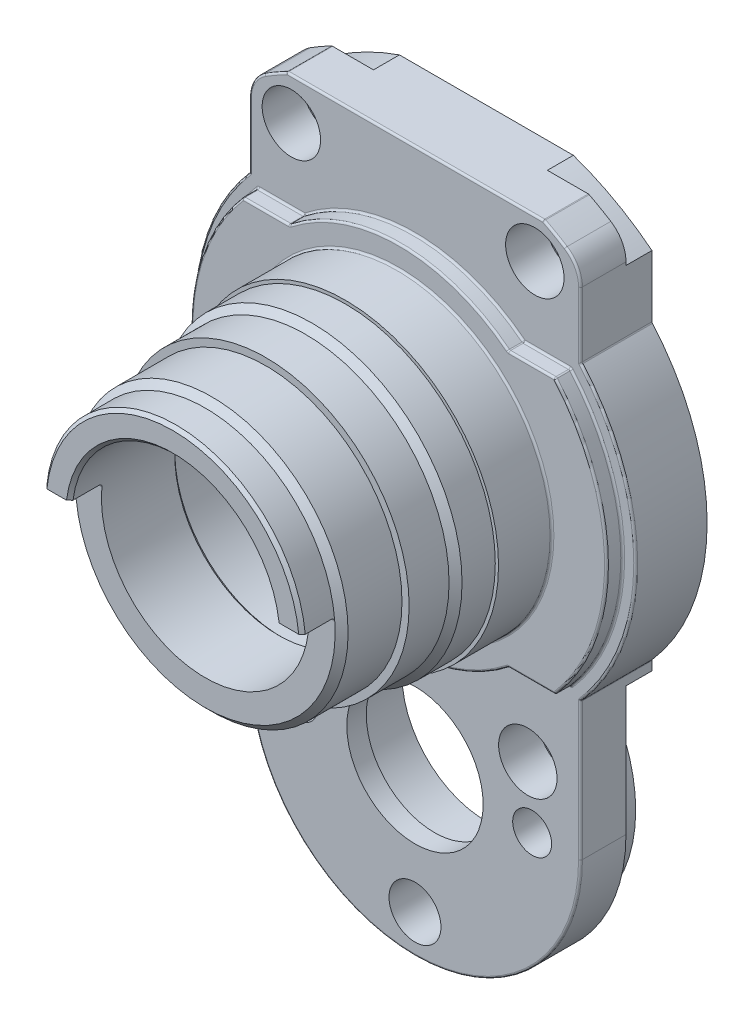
SolidWorks part; units mm, degrees
ref_plane "Plan de face" through (0, 0, 0) normal (0, 0, 1) x (1, 0, 0)
ref_plane "Plan de dessus" through (0, 0, 0) normal (0, 1, 0) x (1, 0, 0)
ref_plane "Plan de droite" through (0, 0, 0) normal (1, 0, 0) x (0, 0, -1)
sketch "Esquisse1" plane through (0, 0, 0) normal (0, 0, 1) x (1, 0, 0)
  line L0 (-25.5, -22.4889) -> (-25.5, -43.8)
  line L1 (-19.7658, 38.75) -> (19.7658, 38.75)
  line L2 (-25.5, 32.5883) -> (-25.5, 22.4889)
  line L3 (25.5, -22.4889) -> (25.5, -43.8)
  line L4 (25.5, 32.5883) -> (25.5, 22.4889)
  circle A0 centre (0, 0) radius 21
  arc A1 (25.5, -22.4889) -> (25.5, 22.4889) centre (0, 0) ccw
  arc A2 (-25.5, -43.8) -> (25.5, -43.8) centre (0, -43.8) ccw
  arc A3 (-25.5, 22.4889) -> (-25.5, -22.4889) centre (0, 0) ccw
  circle A4 centre (0, -43.8) radius 10.5
  arc A5 (-19.7658, 38.75) -> (-23.1623, 36.8206) centre (0, 0) ccw
  arc A6 (-23.1623, 36.8206) -> (-25.5, 32.5883) centre (-20.5, 32.5883) ccw
  arc A7 (23.1623, 36.8206) -> (19.7658, 38.75) centre (0, 0) ccw
  arc A8 (25.5, 32.5883) -> (23.1623, 36.8206) centre (20.5, 32.5883) ccw
  dimension "D1" = 42
  dimension "D2" = 68
  dimension "D6" = 43.8
  dimension "D7" = 21
  dimension "D8" = 10
  dimension "D5" = 10
  dimension "D3" = 38.75
  dimension "D4" = 51
extrude "Extrusion1" add sketch "Esquisse1" along normal blind 11
sketch "Esquisse2" plane through (0, 0, 11) normal (0, 0, 1) x (1, 0, 0)
  line L0 (16.8461, 21.1) -> (24.0581, 21.1)
  line L1 (-24.0581, 21.1) -> (-16.8461, 21.1)
  line L2 (16.8461, -21.1) -> (24.0581, -21.1)
  line L3 (-24.0581, -21.1) -> (-16.8461, -21.1)
  arc A0 (24.0581, -21.1) -> (24.0581, 21.1) centre (0, 0) ccw
  arc A1 (16.8461, 21.1) -> (-16.8461, 21.1) centre (0, 0) ccw
  arc A2 (-24.0581, 21.1) -> (-24.0581, -21.1) centre (0, 0) ccw
  arc A3 (-16.8461, -21.1) -> (16.8461, -21.1) centre (0, 0) ccw
  circle A4 centre (0, 0) radius 21
  dimension "D3" = 64
  dimension "D4" = 54
  dimension "D1" = 42.2
  dimension "D2" = 21.1
extrude "Extrusion2" add sketch "Esquisse2" along normal blind 2.5
hole_wizard "Chambrage pour vis à tête hexagonale M51" positions "Esquisse3D1" profile "Esquisse3" counterbore size "M5" standard "ISO"
sketch3d "Esquisse3D1"
  line L0 (0, 0, 11) -> (0, 0, 0) construction
  point P0 (-19.0407, 32.3064, 11)
  point P2 (18.4578, 32.6429, 11)
  point P4 (-17.38, -34.645, 11)
  point P6 (17.38, -34.645, 11)
  dimension "D1" = 37.5
  dimension "D2" = 37.5
  dimension "D4" = 38.76
  dimension "D3" = 37.5
  dimension "D5" = 38.76
  dimension "D6" = 34.76
  dimension "D7" = 19.0407
  dimension "D8" = 17.38
sketch "Esquisse3" plane through (-19.0407, 32.3064, 11) normal (1, 0, 0) x (0, -1, 0)
  line L0 (0, 0) -> (0, 11)
  line L1 (0, 11) -> (2.6, 11)
  line L3 (2.6, 11) -> (2.6, 6.2)
  line L4 (2.6, 6.2) -> (4.5, 6.2)
  line L5 (4.5, 6.2) -> (4.5, 0)
  line L7 (4.5, 0) -> (0, 0)
  line L11 (0, -6.35) -> (0, 107.95) construction
  dimension "Diamètre du perçage jusqu'au prochain" = 5.2
  dimension "Profondeur du perçage jusqu'au prochain" = 11
  dimension "Diamètre du chambrage" = 9
  dimension "Profondeur du chambrage" = 6.2
hole_wizard "Diamètre du perçage Ø6.0 " positions "Esquisse3D2" profile "Esquisse4" hole size "Ø6.0" standard "ISO"
sketch3d "Esquisse3D2"
  line L0 (0, 0, 11) -> (0, 0, 0) construction
  point P0 (-18.05, -43.7963, 11)
  point P2 (18.05, -43.7963, 11)
  dimension "D1" = 47.37
  dimension "D2" = 47.37
  dimension "D3" = 36.1
  dimension "D4" = 18.05
sketch "Esquisse4" plane through (-18.05, -43.7963, 11) normal (1, 0, 0) x (0, -1, 0)
  line L0 (0, 0) -> (0, 11)
  line L1 (0, 11) -> (3, 11)
  line L2 (3, 11) -> (3, 0)
  line L5 (3, 0) -> (0, 0)
  line L11 (0, -6.35) -> (0, 107.95) construction
  dimension "Diamètre du perçage jusqu'au prochain" = 6
  dimension "Profondeur du perçage jusqu'au prochain" = 11
hole_wizard "Chambrage pour vis à tête hexagonale M31" positions "Esquisse3D3" profile "Esquisse5" counterbore size "M3" standard "ISO"
sketch3d "Esquisse3D3"
  line L0 (0, 0, 11) -> (0, 0, 0) construction
  point P0 (0, -63.4, 11)
  dimension "D1" = 63.4
sketch "Esquisse5" plane through (0, -63.4, 11) normal (1, 0, 0) x (0, -1, 0)
  line L0 (0, 0) -> (0, 11)
  line L1 (0, 11) -> (1.6, 11)
  line L3 (1.6, 11) -> (1.6, 6.2)
  line L4 (1.6, 6.2) -> (4, 6.2)
  line L5 (4, 6.2) -> (4, 0)
  line L7 (4, 0) -> (0, 0)
  line L11 (0, -6.35) -> (0, 107.95) construction
  dimension "Diamètre du perçage jusqu'au prochain" = 3.2
  dimension "Profondeur du perçage jusqu'au prochain" = 11
  dimension "Diamètre du chambrage" = 8
  dimension "Profondeur du chambrage" = 6.2
sketch "Esquisse6" plane through (0, 0, 0) normal (0, 0, -1) x (-1, 0, 0)
  line L0 (-35, 0) -> (-35, -75.2632)
  line L1 (-35, -75.2632) -> (35, -75.2632)
  line L2 (35, -75.2632) -> (35, 0)
  line L3 (-35, 21.3542) -> (-35, 46.0443)
  line L4 (-35, 46.0443) -> (35, 46.0443)
  line L5 (35, 46.0443) -> (35, 21.3542)
  arc A0 (-19.2363, -31.1919) -> (19.2363, -31.1919) centre (0, -43.8) ccw
  arc A1 (19.6692, -28.9504) -> (35, 0) centre (0, 0) ccw
  arc A2 (-19.2363, -31.1919) -> (-19.6692, -28.9504) centre (-18.2829, -29.8452) ccw
  arc A3 (19.6692, -28.9504) -> (19.2363, -31.1919) centre (18.2829, -29.8452) ccw
  arc A4 (-35, 0) -> (-19.6692, -28.9504) centre (0, 0) ccw
  arc A5 (35, 21.3542) -> (-35, 21.3542) centre (0, 0) ccw
  dimension "D1" = 46
  dimension "D2" = 70
  dimension "D3" = 3.3
  dimension "D4" = 3.3
  dimension "D5" = 82
extrude "Extrusion3" cut sketch "Esquisse6" against normal blind 4
fillet "Congé2" radius 0.3 24 edges at (-32, 0, 13.5) (-32, 0, 11) (-24.0581, -21.1, 12.25) (-20.4521, -21.1, 13.5) (-20.4521, -21.1, 11) (-16.8461, -21.1, 12.25) (0, -27, 13.5) (0, -27, 11) (16.8461, -21.1, 12.25) (20.4521, -21.1, 13.5) (20.4521, -21.1, 11) (24.0581, -21.1, 12.25) (32, 0, 13.5) (32, 0, 11) (24.0581, 21.1, 12.25) (20.4521, 21.1, 13.5) (20.4521, 21.1, 11) (16.8461, 21.1, 12.25) (0, 27, 13.5) (0, 27, 11) (-16.8461, 21.1, 12.25) (-20.4521, 21.1, 13.5) (-24.0581, 21.1, 12.25) (-20.4521, 21.1, 11)
fillet "Congé3" radius 0.3 12 edges at (21.4857, 37.8234, 11) (24.8767, 35.0058, 11) (25.5, -33.1444, 11) (0, -69.3, 11) (-25.5, 27.5386, 11) (-24.8767, 35.0058, 11) (25.5, 27.5386, 11) (34, 0, 11) (-25.5, -33.1444, 11) (-34, 0, 11) (-21.4857, 37.8234, 11) (0, 38.75, 11)
fillet "Congé4" radius 0.3 12 edges at (-25.4412, -22.4667, 10.8783) (-25.4412, 22.4667, 10.8783) (25.4412, -22.4667, 10.8783) (25.4412, 22.4667, 10.8783) (-25.5, -22.4889, 5.35) (-25.5, 22.4889, 5.35) (25.5, -22.4889, 5.35) (25.5, 22.4889, 5.35) (19.7507, 38.6873, 10.8835) (-19.7507, 38.6873, 10.8835) (19.7658, 38.75, 7.35) (-19.7658, 38.75, 7.35)
sketch "Esquisse7" plane through (0, 0, 0) normal (0, 0, -1) x (-1, 0, 0)
  circle A0 centre (0, -43.8) radius 13
  dimension "D1" = 26
extrude "Extrusion4" cut sketch "Esquisse7" against normal blind 8
sketch "Esquisse9" plane through (0, 0, 0) normal (1, 0, 0) x (0, 0, -1)
  line L0 (-13.5, 23.6) -> (-21.73, 23.6)
  line L1 (-13.5, 20.8) -> (-13.5, -20.8) construction
  line L2 (-21.73, 23.6) -> (-21.73, 23.1)
  line L3 (-21.73, 23.1) -> (-27.85, 23.1)
  line L4 (-27.85, 23.1) -> (-27.85, 22.1)
  line L5 (-27.85, 22.1) -> (-34, 22.1)
  line L6 (-34, 22.1) -> (-34, 21)
  line L7 (-34, 21) -> (-43.3, 21)
  line L8 (-43.3, 21) -> (-43.3, 20)
  line L9 (-43.3, 20) -> (-48.3, 20)
  line L10 (-48.3, 20) -> (-48.3, 16)
  line L11 (-48.3, 16) -> (-31.5, 16)
  line L12 (-31.5, 16) -> (-31.5, 17.5)
  line L13 (-31.5, 17.5) -> (-23, 17.5)
  line L14 (-23, 17.5) -> (-23, 18.5)
  line L15 (-23, 18.5) -> (-18.5, 18.5)
  line L16 (-18.5, 18.5) -> (-18.5, 21)
  line L17 (-18.5, 21) -> (-13.5, 21)
  line L18 (-13.5, 21) -> (-13.5, 23.6)
  line L19 (-10.7, 0) -> (-4, 0) construction
  dimension "D1" = 34.8
  dimension "D2" = 5
  dimension "D3" = 9.3
  dimension "D4" = 6.15
  dimension "D5" = 6.12
  dimension "D6" = 18.5
  dimension "D7" = 4.5
  dimension "D8" = 8.5
  dimension "D9" = 2.5
  dimension "D10" = 1
  dimension "D11" = 1.5
  dimension "D12" = 1
  dimension "D13" = 1
  dimension "D14" = 0.5
  dimension "D15" = 2.6
  dimension "D16" = 2.6
  dimension "D17" = 21
revolve "Révolution1" add sketch "Esquisse9" angle 360 about axis through (0, 0, 11) along (0, 0, -1)
fillet "Congé5" radius 0.3 1 edges at (23.6, 0, 13.5)
chamfer "Chanfrein1" distance 1 angle 45 1 edges at (23.1, 0, 27.85)
fillet "Congé6" radius 0.2 1 edges at (17.5, 0, 31.5)
chamfer "Chanfrein3" distance 0.5 angle 45 1 edges at (16, 0, 31.5)
sketch "Esquisse11" plane through (0, 0, 0) normal (1, 0, 0) x (0, 0, -1)
  line L1 (-43.3, -20) -> (-51.5048, -20)
  line L2 (-43.3, -20) -> (-43.3, 2)
  line L3 (-43.3, 2) -> (-51.5048, 2)
  line L4 (-51.5048, -20) -> (-51.5048, 2)
  dimension "D1" = 22
extrude "Extrusion5" cut sketch "Esquisse11" against normal through all and the other way through all
chamfer "Chanfrein5" distance 0.5 angle 45 4 edges at (-17.8871, 2, 48.3) (17.8871, 2, 48.3) (0, 16, 48.3) (0, 20, 48.3)
fillet "Congé7" radius 0.5 2 edges at (-17.8871, 2, 43.3) (17.8871, 2, 43.3)
chamfer "Chanfrein6" distance 1 angle 45 1 edges at (21, 0, 43.3)
